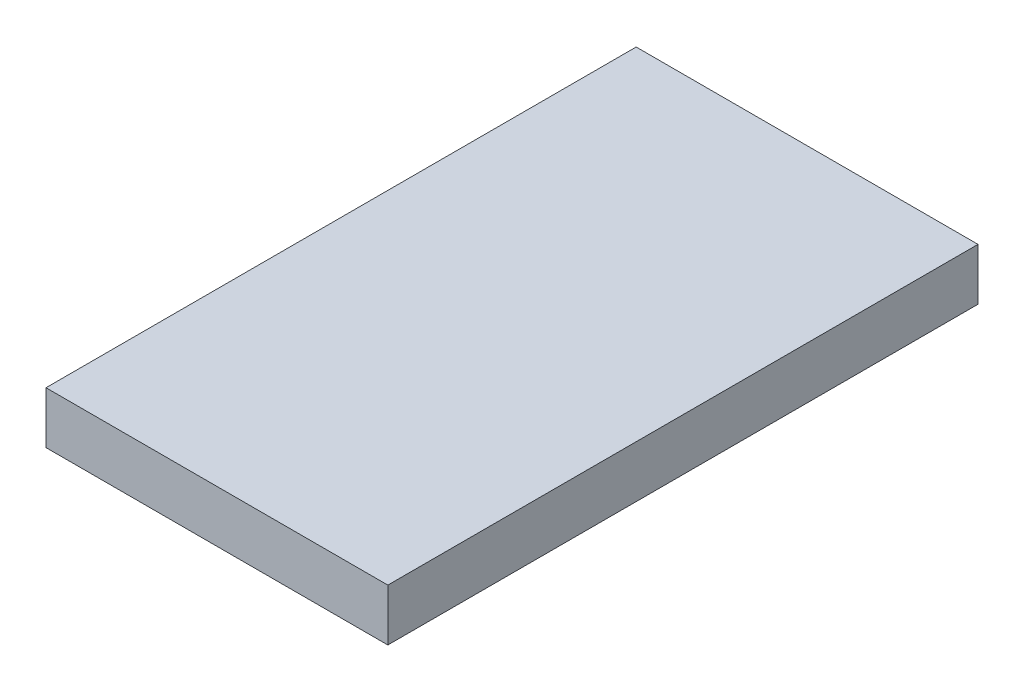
SolidWorks part; units mm, degrees
ref_plane "Front Plane" through (0, 0, 0) normal (0, 0, 1) x (1, 0, 0)
ref_plane "Top Plane" through (0, 0, 0) normal (0, 1, 0) x (1, 0, 0)
ref_plane "Right Plane" through (0, 0, 0) normal (1, 0, 0) x (0, 0, -1)
sketch "Sketch1" plane through (0, 0, 0) normal (0, -1, 0) x (1, 0, 0)
  line L1 (0, 149.2) -> (-334.6766, 149.2)
  line L2 (0, 149.2) -> (0, -428.6)
  line L3 (0, -428.6) -> (-334.6766, -428.6)
  line L4 (-334.6766, 149.2) -> (-334.6766, -428.6)
extrude "Extrude1" add sketch "Sketch1" along normal blind 50.8
